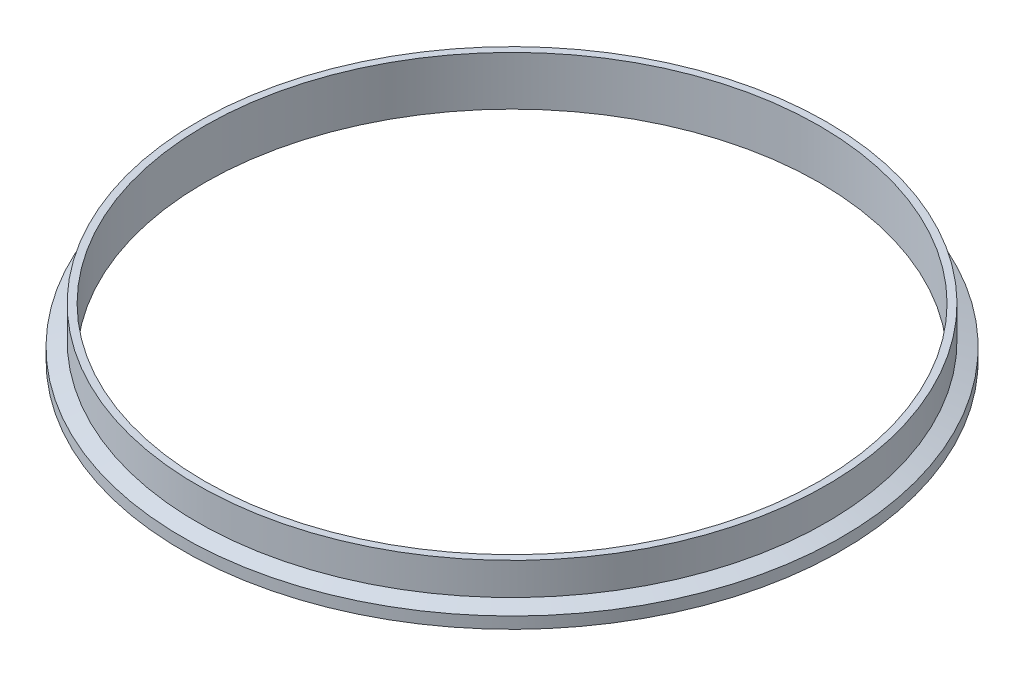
SolidWorks part; units mm, degrees
ref_plane "Front Plane" through (0, 0, 0) normal (0, 0, 1) x (1, 0, 0)
ref_plane "Top Plane" through (0, 0, 0) normal (0, 1, 0) x (1, 0, 0)
ref_plane "Right Plane" through (0, 0, 0) normal (1, 0, 0) x (0, 0, -1)
sketch "Sketch1" plane through (0, 0, 0) normal (0, 0, 1) x (1, 0, 0)
  line L0 (0, 0) -> (0, 23.8125) construction
  line L1 (0, 23.8125) -> (-152.4, 23.8125)
  line L2 (-152.4, 23.8125) -> (-152.4, 8.2228)
  line L3 (-152.4, 8.2228) -> (-159.639, 5.588)
  line L4 (-159.639, 5.588) -> (-159.639, 0)
  line L5 (-159.639, 0) -> (-156.1992, 0)
  line L6 (-152.5632, 0) -> (0, 0)
  line L7 (0, 0) -> (0, 23.8125)
  line L8 (0, 23.8125) -> (-148.9964, 23.8125)
  line L9 (-148.9964, 23.8125) -> (-148.9964, 0)
  line L10 (-148.9964, 0) -> (0, 0)
  line L11 (0, 0) -> (-0.1846, 0.0129)
  arc A0 (-155.4767, 0.4745) -> (-153.2857, 0.4745) centre (-154.3812, 0) cw
  arc A1 (-152.5632, 0) -> (-153.2857, 0.4745) centre (-152.5632, 0.7874) cw
  arc A2 (-155.4767, 0.4745) -> (-156.1992, 0) centre (-156.1992, 0.7874) cw
  point P12 (-153.1874, 0)
  dimension "D6" = 1.1938
  dimension "D7" = 0.7874
  dimension "3.00" = 152.4
  dimension "D2" = 5.588
  dimension "D3" = 159.639
  dimension "D4" = 70
  dimension "D5" = 154.3812
  dimension "D8" = 3.4036
  dimension "D9" = 23.8125
revolve "Revolve2" add sketch "Sketch1" angle 360 about L0
